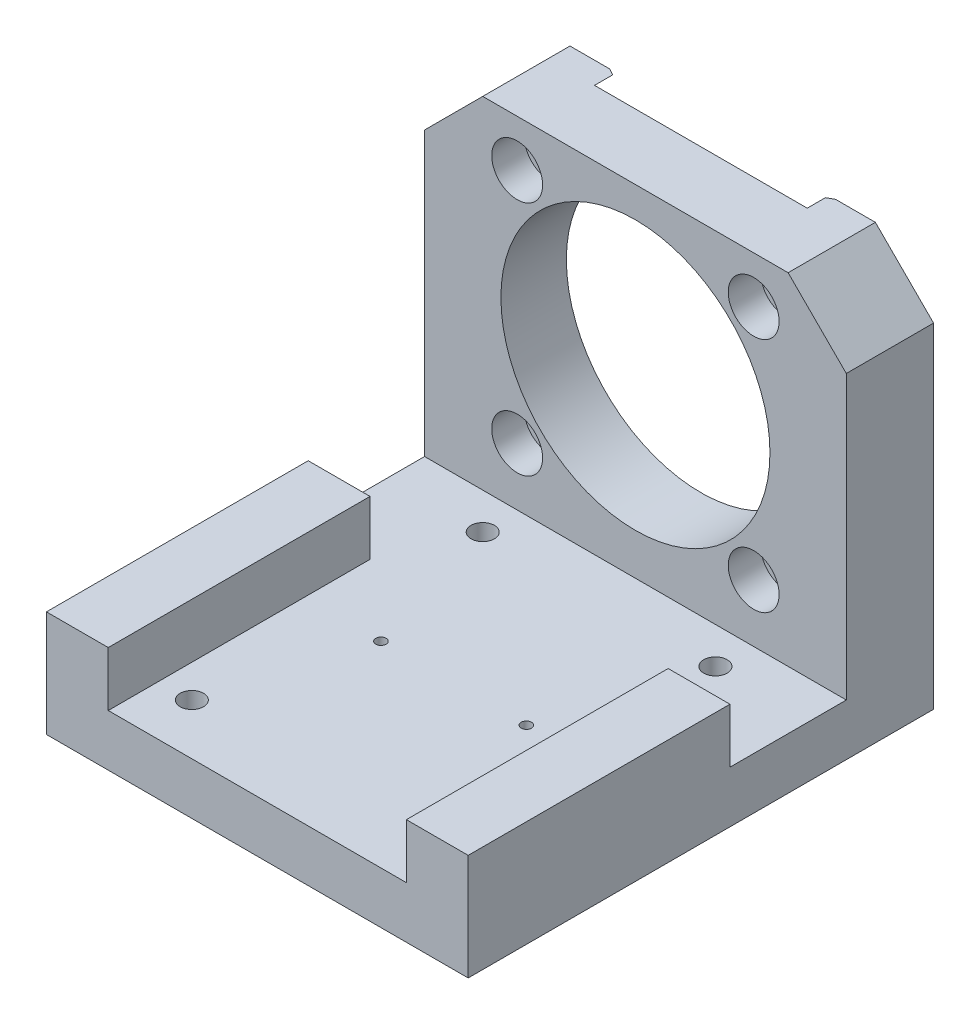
SolidWorks part; units mm, degrees
ref_plane "Front Plane" through (0, 0, 0) normal (0, 0, 1) x (1, 0, 0)
ref_plane "Top Plane" through (0, 0, 0) normal (0, 1, 0) x (1, 0, 0)
ref_plane "Right Plane" through (0, 0, 0) normal (1, 0, 0) x (0, 0, -1)
sketch "Sketch1" plane through (0, 0, 0) normal (1, 0, 0) x (0, 0, -1)
  line L0 (0, 0) -> (0, 85.725)
  line L1 (0, 85.725) -> (-19.05, 85.725)
  line L2 (-19.05, 85.725) -> (-19.05, 23.1902)
  line L3 (-19.05, 23.1902) -> (-101.6, 23.1902)
  line L4 (-101.6, 23.1902) -> (-101.6, 0)
  line L5 (-101.6, 0) -> (0, 0)
  dimension "D1" = 23.1902
  dimension "D2" = 19.05
  dimension "D3" = 85.725
  dimension "D4" = 101.6
extrude "Boss-Extrude1" add sketch "Sketch1" along normal mid plane 92.075
sketch "Sketch2" plane through (0, 0, 0) normal (0, 0, -1) x (-1, 0, 0)
  line L0 (-46.0375, 0) -> (46.0375, 0) construction
  circle A0 centre (0, 49.6964) radius 29.3688
  dimension "D1" = 58.7375
  dimension "D2" = 49.6964
extrude "Cut-Extrude1" cut sketch "Sketch2" against normal through all
chamfer "Chamfer1" distance 12.7 angle 45 2 edges at (-46.0375, 85.725, 9.525) (46.0375, 85.725, 9.525)
hole_wizard "1/4-20 Tapped Hole1" positions "Sketch4" profile "Sketch3" tap size "1/4-20" standard "ANSI Inch"
sketch "Sketch4" plane through (48.5962, 23.1902, -3.6946) normal (0, 1, 0) x (1, 0, 0)
  line L0 (-48.5962, -3.6946) -> (-48.5962, -145.4704) construction
  line L2 (-73.9962, -94.1821) -> (-23.1962, -94.1821) construction
  line L3 (-23.1962, -94.1821) -> (-23.1962, -30.6821) construction
  line L4 (-23.1962, -30.6821) -> (-73.9962, -30.6821) construction
  line L5 (-73.9962, -30.6821) -> (-73.9962, -94.1821) construction
  line L7 (-2.5587, -105.2946) -> (-35.9491, -105.2946) construction
  point P0 (-73.9962, -94.1821)
  point P6 (-23.1962, -94.1821)
  point P8 (-23.1962, -30.6821)
  point P10 (-73.9962, -30.6821)
  point P23 (-48.5962, -94.1821)
  dimension "D1" = 50.8
  dimension "D2" = 63.5
  dimension "D3" = 11.1125
sketch "Sketch3" plane through (-25.4, 23.1902, 90.4875) normal (1, 0, 0) x (0, 0, 1)
  line L0 (0, 0) -> (0, 23.1902)
  line L1 (0, 23.1902) -> (2.5527, 23.1902)
  line L2 (2.5527, 23.1902) -> (2.5527, 0)
  line L5 (2.5527, 0) -> (0, 0)
  line L11 (0, -6.35) -> (0, 107.95) construction
  dimension "Thru Tap Drill Dia." = 5.1054
  dimension "Thru Tap Drill Depth" = 23.1902
sketch "Sketch5" plane through (0, 0, 0) normal (0, -1, 0) x (1, 0, 0)
  line L0 (0, 0) -> (0, 58.7375) construction
  line L1 (26.9875, 62.7375) -> (-26.9875, 62.7375)
  line L2 (26.9875, 62.7375) -> (26.9875, 54.7375) construction
  line L3 (26.9875, 54.7375) -> (-26.9875, 54.7375)
  line L4 (-26.9875, 62.7375) -> (-26.9875, 54.7375) construction
  line L5 (26.9875, 62.7375) -> (-26.9875, 54.7375) construction
  line L6 (26.9875, 54.7375) -> (-26.9875, 62.7375) construction
  line L7 (25.4, 58.7375) -> (0, 58.7375) construction
  line L8 (25.4, 90.4875) -> (25.4, 26.9875) construction
  arc A0 (26.9875, 62.7375) -> (26.9875, 54.7375) centre (26.9875, 58.7375) cw
  arc A1 (-26.9875, 62.7375) -> (-26.9875, 54.7375) centre (-26.9875, 58.7375) ccw
  point P0 (0, 58.7375)
  dimension "D1" = 8
  dimension "D2" = 53.975
extrude "Cut-Extrude2" cut sketch "Sketch5" against normal blind 3.5
sketch "Sketch6" plane through (0, 23.1902, 0) normal (0, 1, 0) x (1, 0, 0)
  line L0 (46.0375, -101.6) -> (12.647, -101.6) construction
  line L1 (-9.525, -101.6) -> (9.525, -101.6)
  line L2 (-9.525, -101.6) -> (-9.525, -44.45)
  line L3 (-9.525, -44.45) -> (9.525, -44.45) construction
  line L4 (9.525, -101.6) -> (9.525, -44.45)
  line L5 (46.0375, -19.05) -> (12.647, -19.05) construction
  arc A0 (-9.525, -44.45) -> (9.525, -44.45) centre (0, -44.45) cw
  dimension "D1" = 19.05
  dimension "D2" = 25.4
extrude "Cut-Extrude3" cut sketch "Sketch6" against normal blind 6.35
hole_wizard "CBORE for 1/4 Socket Head Cap Screw2" positions "Sketch8" profile "Sketch7" counterbore size "1/4" standard "ANSI Inch"
sketch "Sketch8" plane through (0, 0, 19.05) normal (0, 0, 1) x (1, 0, 0)
  line L0 (0, 49.6964) -> (-25.8182, 75.5146) construction
  line L2 (0, 49.6964) -> (-65.8803, 49.6964) construction
  circle A0 centre (0, 49.6964) radius 36.5125 construction
  point P0 (-25.8182, 75.5146)
  dimension "D1" = 73.025
  dimension "D2" = 45
sketch "Sketch7" plane through (-25.8182, 75.5146, 19.05) normal (1, 0, 0) x (0, -1, 0)
  line L0 (0, 0) -> (0, 19.051)
  line L1 (0, 19.051) -> (3.5719, 19.051)
  line L3 (3.5719, 19.051) -> (3.5719, 7.112)
  line L4 (3.5719, 7.112) -> (5.5562, 7.112)
  line L5 (5.5562, 7.112) -> (5.5562, 0)
  line L7 (5.5562, 0) -> (0, 0)
  line L11 (0, -6.35) -> (0, 107.95) construction
  dimension "Thru Hole Dia." = 7.1437
  dimension "Thru Hole Depth" = 19.051
  dimension "C'Bore Dia." = 11.1125
  dimension "C'Bore Depth" = 7.112
pattern_circular "CirPattern1" count 4 over 360 about axis through (0, 49.6964, 0) along (0, 0, 1) of "CBORE for 1/4 Socket Head Cap Screw2"
sketch "Sketch9" plane through (0, 23.1902, 0) normal (0, 1, 0) x (1, 0, 0)
  line L0 (-12.647, -101.6) -> (-46.0375, -101.6) construction
  line L1 (-32.5437, -101.6) -> (32.5438, -101.6)
  line L2 (-32.5437, -101.6) -> (-32.5437, -31.75)
  line L3 (-32.5437, -31.75) -> (32.5438, -31.75)
  line L4 (32.5438, -101.6) -> (32.5438, -31.75)
  line L6 (0, 0) -> (0, -31.75) construction
  line L7 (-31.3317, -19.05) -> (-46.0375, -19.05) construction
  dimension "D1" = 65.0875
  dimension "D2" = 12.7
extrude "Cut-Extrude4" cut sketch "Sketch9" against normal blind 11.9062
sketch "Sketch10" plane through (0, 23.1902, 0) normal (0, 1, 0) x (1, 0, 0)
  line L0 (46.0375, -19.05) -> (46.0375, -101.6) construction
  line L1 (-46.0375, -19.05) -> (46.0375, -19.05)
  line L2 (-46.0375, -19.05) -> (-46.0375, -44.45)
  line L3 (-46.0375, -44.45) -> (46.0375, -44.45)
  line L4 (46.0375, -19.05) -> (46.0375, -44.45)
  dimension "D1" = 25.4
extrude "Cut-Extrude5" cut sketch "Sketch10" against normal up to surface (11.9062 mm away)
sketch "Sketch11" plane through (0, 0, 0) normal (0, 0, -1) x (-1, 0, 0)
  circle A0 centre (0, 49.6964) radius 42.8625
  dimension "D1" = 85.725
extrude "Cut-Extrude6" cut sketch "Sketch11" against normal blind 4.7625
sketch "Sketch12" plane through (0, 0, 19.05) normal (0, 0, 1) x (1, 0, 0)
  circle A0 centre (-25.8182, 23.8781) radius 5.5562
  circle A1 centre (25.8182, 23.8781) radius 5.5562
  circle A2 centre (25.8182, 23.8781) radius 5.5562 construction
  circle A3 centre (-25.8182, 23.8781) radius 5.5562 construction
extrude "Cut-Extrude7" [suppressed] cut sketch "Sketch12" along normal through all
chamfer "Chamfer2" distance 0.7937 angle 45 1 edges at (0, 6.8339, 0)
hole_wizard "#4-40 Tapped Hole1" positions "Sketch14" profile "Sketch13" tap size "#4-40" standard "ANSI Inch"
sketch "Sketch14" plane through (0, 3.5, 0) normal (0, -1, 0) x (-1, 0, 0)
  line L0 (15.875, -58.7375) -> (-15.875, -58.7375) construction
  line L2 (0, -58.7375) -> (0, -101.6) construction
  line L4 (-46.0375, -101.6) -> (46.0375, -101.6) construction
  line L5 (26.9875, -58.7375) -> (15.875, -58.7375) construction
  point P0 (15.875, -58.7375)
  point P1 (-15.875, -58.7375)
  dimension "D1" = 31.75
sketch "Sketch13" plane through (-15.875, 3.5, 58.7375) normal (1, 0, 0) x (0, 0, -1)
  line L0 (0, 0) -> (0, 82.225)
  line L1 (0, 82.225) -> (1.1303, 82.225)
  line L2 (1.1303, 82.225) -> (1.1303, 0)
  line L5 (1.1303, 0) -> (0, 0)
  line L11 (0, -6.35) -> (0, 107.95) construction
  dimension "Thru Tap Drill Dia." = 2.2606
  dimension "Thru Tap Drill Depth" = 82.225
